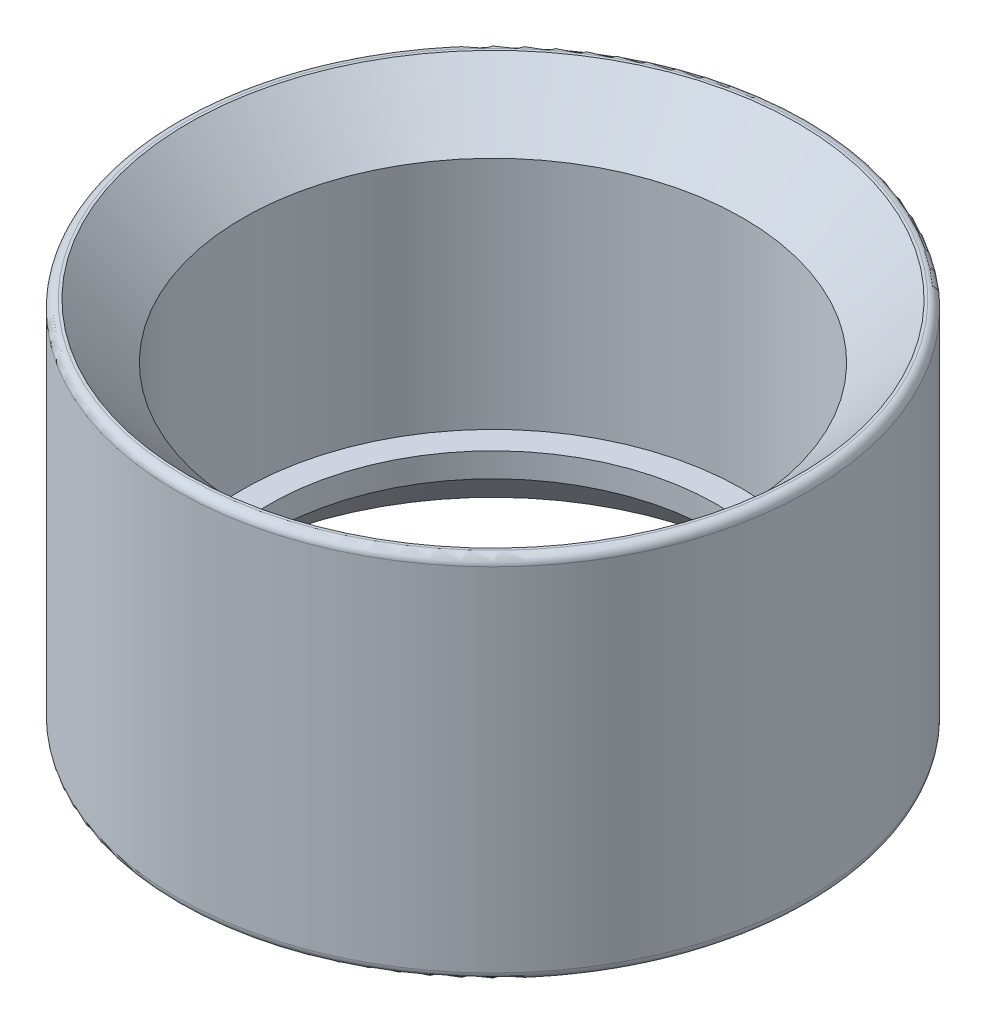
SolidWorks part; units mm, degrees
ref_plane "Front Plane" through (0, 0, 0) normal (0, 0, 1) x (1, 0, 0)
ref_plane "Top Plane" through (0, 0, 0) normal (0, 1, 0) x (1, 0, 0)
ref_plane "Right Plane" through (0, 0, 0) normal (1, 0, 0) x (0, 0, -1)
sketch "Sketch1" plane through (0, 0, 0) normal (0, 1, 0) x (1, 0, 0)
  circle A0 centre (0, 0) radius 19.05
  circle A1 centre (0, 0) radius 13.5001
extrude "Boss-Extrude1" add sketch "Sketch1" along normal blind 4.7625
sketch "Sketch2" plane through (0, 4.7625, 0) normal (0, 1, 0) x (1, 0, 0)
  circle A0 centre (0, 0) radius 19.05
  circle A1 centre (0, 0) radius 15.0813
extrude "Boss-Extrude2" add sketch "Sketch2" along normal blind 17.4625
chamfer "Chamfer1" distance 3.302 angle 45 1 edges at (0, 0, 13.5001)
fillet "Fillet1" radius 0.508 1 edges at (0, 0, 19.05)
fillet "Fillet2" radius 0.508 1 edges at (0, 22.225, 19.05)
chamfer "Chamfer2" distance 3.302 angle 45 1 edges at (0, 22.225, 15.0813)
